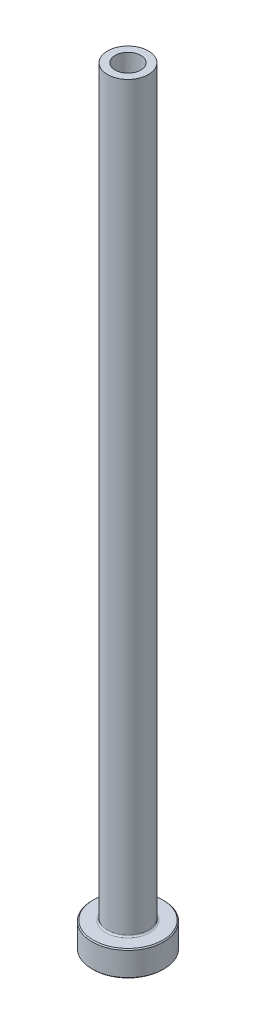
SolidWorks part; units mm, degrees
ref_plane "Front Plane" through (0, 0, 0) normal (0, 0, 1) x (1, 0, 0)
ref_plane "Top Plane" through (0, 0, 0) normal (0, 1, 0) x (1, 0, 0)
ref_plane "Right Plane" through (0, 0, 0) normal (1, 0, 0) x (0, 0, -1)
sketch "Sketch1" plane through (0, 0, 0) normal (0, 0, 1) x (1, 0, 0)
  line L0 (-2.5, 150) -> (-4, 150)
  line L1 (-4, 150) -> (-4, 5)
  line L2 (-4, 5) -> (-7, 5)
  line L3 (-7, 5) -> (-7, 0)
  line L4 (7.7, 0) -> (-7.7, 0) construction
  line L5 (-7, 0) -> (-2.75, 0)
  line L6 (-2.5, 105) -> (-2.5, 150)
  line L7 (0, 92.1877) -> (0, -15.5353) construction
  line L8 (0, -7.7) -> (0, 7.7) construction
  line L9 (-2.5, 105) -> (-2.75, 93)
  line L10 (-2.75, 93) -> (-2.75, 0)
  dimension "D1" = 0.25
  dimension "ID" = 5
  dimension "OD" = 8
  dimension "L" = 150
  dimension "H" = 14
  dimension "T" = 5
  dimension "N" = 45
  dimension "D2" = 12
revolve "Revolve1" add sketch "Sketch1" angle 360 about L7
fillet "Fillet1" radius 0.3 1 edges at (0, 5, 4)
chamfer "Chamfer1" distance 0.2 angle 45 2 edges at (0, 5, 7) (0, 0, 7)
chamfer "Chamfer3" distance 0.5 angle 45 1 edges at (0, 0, 2.75)
